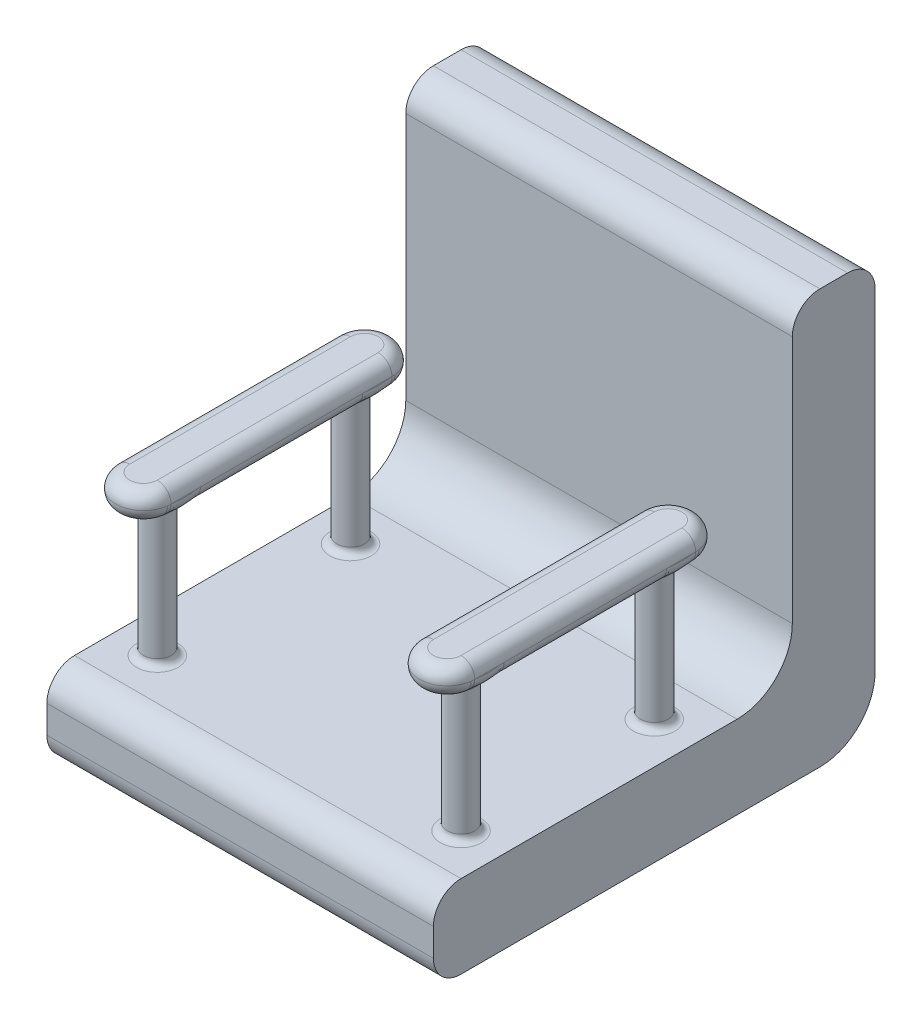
SolidWorks part; units mm, degrees
ref_plane "Front Plane" through (0, 0, 0) normal (0, 0, 1) x (1, 0, 0)
ref_plane "Top Plane" through (0, 0, 0) normal (0, 1, 0) x (1, 0, 0)
ref_plane "Right Plane" through (0, 0, 0) normal (1, 0, 0) x (0, 0, -1)
sketch "Croquis1" plane through (0, 0, 0) normal (0, 1, 0) x (1, 0, 0)
  line L1 (-7, 8) -> (7, 8)
  line L2 (-7, 8) -> (-7, -8)
  line L3 (-7, -8) -> (7, -8)
  line L4 (7, 8) -> (7, -8)
  line L5 (-7, 8) -> (7, -8) construction
  line L6 (-7, -8) -> (7, 8) construction
  point P0 (0, 0)
  dimension "D1" = 16
  dimension "D2" = 14
extrude "Saliente-Extruir1" add sketch "Croquis1" along normal blind 3
shell "Vaciado1" thickness 1
sketch "Croquis3" plane through (0, 3, 0) normal (0, 1, 0) x (1, 0, 0)
  line L0 (7, -8) -> (7, 8) construction
  line L1 (-7, 8) -> (7, 8)
  line L2 (-7, 8) -> (-7, 5)
  line L3 (-7, 5) -> (7, 5)
  line L4 (7, 8) -> (7, 5)
  dimension "D1" = 3
extrude "Saliente-Extruir2" add sketch "Croquis3" along normal blind 12
sketch "Croquis4" plane through (0, 2, 0) normal (0, -1, 0) x (1, 0, 0)
  circle A0 centre (0, 0) radius 2.7
  circle A1 centre (0, 0) radius 1.7
  dimension "D1" = 5.4
  dimension "D2" = 1
extrude "Saliente-Extruir3" add sketch "Croquis4" along normal blind 2
fillet "Redondeo1" radius 2 2 edges at (0, 0, -8)
fillet "Redondeo2" radius 1 4 edges at (0, 3, 8) (0, 0, 8) (0, 15, -8) (0, 15, -5)
sketch "Croquis5" plane through (0, 3, 0) normal (0, 1, 0) x (1, 0, 0)
  line L0 (-7, 3) -> (-7, -7) construction
  line L1 (7, 3) -> (-7, 3) construction
  line L2 (0, 3) -> (0, -0.7151) construction
  line L3 (-7, -2) -> (-3.3686, -2) construction
  circle A0 centre (-5.5, 1.5) radius 0.5
  circle A1 centre (5.5, 1.5) radius 0.5
  circle A2 centre (5.5, -5.5) radius 0.5
  circle A3 centre (-5.5, -5.5) radius 0.5
  dimension "D1" = 1.5
  dimension "D2" = 1.5
  dimension "D3" = 1
extrude "Saliente-Extruir4" add sketch "Croquis5" along normal blind 5
sketch "Croquis6" plane through (0, 8, 0) normal (0, 1, 0) x (1, 0, 0)
  line L0 (-5.5, 2) -> (-5.5, -6) construction
  line L1 (-4.5, 2) -> (-4.5, -6)
  line L2 (-6.5, 2) -> (-6.5, -6)
  circle A0 centre (-5.5, 1.5) radius 0.5 construction
  circle A1 centre (-5.5, 1.5) radius 0.5 construction
  circle A2 centre (-5.5, -5.5) radius 0.5 construction
  arc A3 (-4.5, 2) -> (-6.5, 2) centre (-5.5, 2) ccw
  arc A4 (-6.5, -6) -> (-4.5, -6) centre (-5.5, -6) ccw
  point P9 (-5.5, -2)
  dimension "D1" = 2
extrude "Saliente-Extruir5" add sketch "Croquis6" along normal blind 1 contours L1 A4 L2 A3
mirror "Simetría1" about plane through (0, 0, 0) normal (1, 0, 0) of "Saliente-Extruir5"
fillet "Redondeo4" radius 0.25 8 edges at (-5.5, 3, 5) (-5.5, 8, 5) (5.5, 3, 6) (5.5, 8, 6) (5.5, 3, -2) (5.5, 8, -2) (-5.5, 8, -1) (-5.5, 3, -1)
fillet "Redondeo5" radius 0.5 8 edges at (-5.5, 8, -3) (-4.5, 8, 2) (-5.5, 8, 7) (-6.5, 8, 2) (-5.5, 9, 7) (-4.5, 9, 2) (-5.5, 9, -3) (-6.5, 9, 2)
fillet "Redondeo6" radius 0.5 8 edges at (5.5, 8, -3) (5.5, 8, 7) (5.5, 9, -3) (5.5, 9, 7) (6.5, 8, 2) (4.5, 9, 2) (4.5, 8, 2) (6.5, 9, 2)
